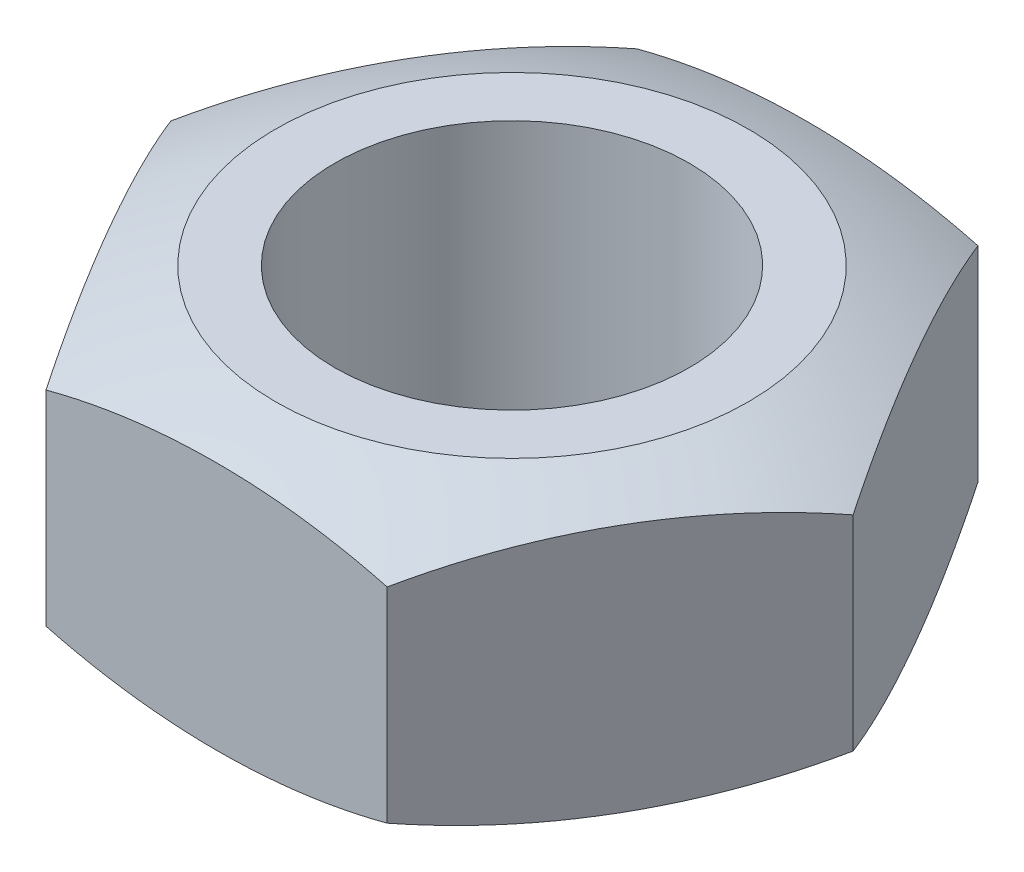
SolidWorks part; units mm, degrees
ref_plane "Front" through (0, 0, 0) normal (0, 0, 1) x (1, 0, 0)
ref_plane "Top" through (0, 0, 0) normal (0, 1, 0) x (1, 0, 0)
ref_plane "Right" through (0, 0, 0) normal (1, 0, 0) x (0, 0, -1)
sketch "profile" plane through (0, 0, 0) normal (0, 1, 0) x (1, 0, 0)
  line L1 (5.7735, 0) -> (2.8868, 5)
  line L2 (2.8868, 5) -> (-2.8868, 5)
  line L3 (-2.8868, 5) -> (-5.7735, 0)
  line L4 (-5.7735, 0) -> (-2.8868, -5)
  line L5 (-2.8868, -5) -> (2.8868, -5)
  line L6 (2.8868, -5) -> (5.7735, 0)
  circle A0 centre (0, 0) radius 5 construction
  dimension "width" = 10
extrude "body" add sketch "profile" along normal blind 5
sketch "thread"
  circle A0 centre (0, 0) radius 3
  dimension "diameter" = 6
revolve "fillet" cut sketch "Sketch7" angle 360 about L0
sketch "Sketch7" plane through (0, 0, 0) normal (0, 0, 1) x (1, 0, 0)
  line L0 (0, 0) -> (0, 5.3875) construction
  line L3 (5.7735, 5) -> (5.7735, 0) construction
  line L4 (2.8868, 0) -> (5.7735, 0) construction
  line L5 (4, 0.8307) -> (4, -1.2581) construction
  line L6 (-0.3098, 2.5) -> (0.7587, 2.5) construction
  line L7 (-2.8868, 0) -> (2.8868, 0) construction
  line L8 (-2.8868, 5) -> (2.8868, 5) construction
  line L9 (5.7735, 4.2312) -> (5.7735, 0.7688)
  line L10 (0, 5.6672) -> (0, 7.5046)
  line L11 (0, 7.5046) -> (6.273, 7.5046)
  line L12 (6.273, 7.5046) -> (6.273, -3.4922)
  line L13 (6.273, -3.4922) -> (0, -3.4922)
  line L14 (0, -3.4922) -> (0, -0.6672)
  arc A0 (0, -0.6672) -> (5.7735, 0.7688) centre (0, 11.6575) ccw
  arc A1 (0, 5.6672) -> (5.7735, 4.2312) centre (0, -6.6575) cw
  point P12 (4, 0)
  dimension "halfwidth" = 4
extrude "hole" cut sketch "thread" against normal through all
